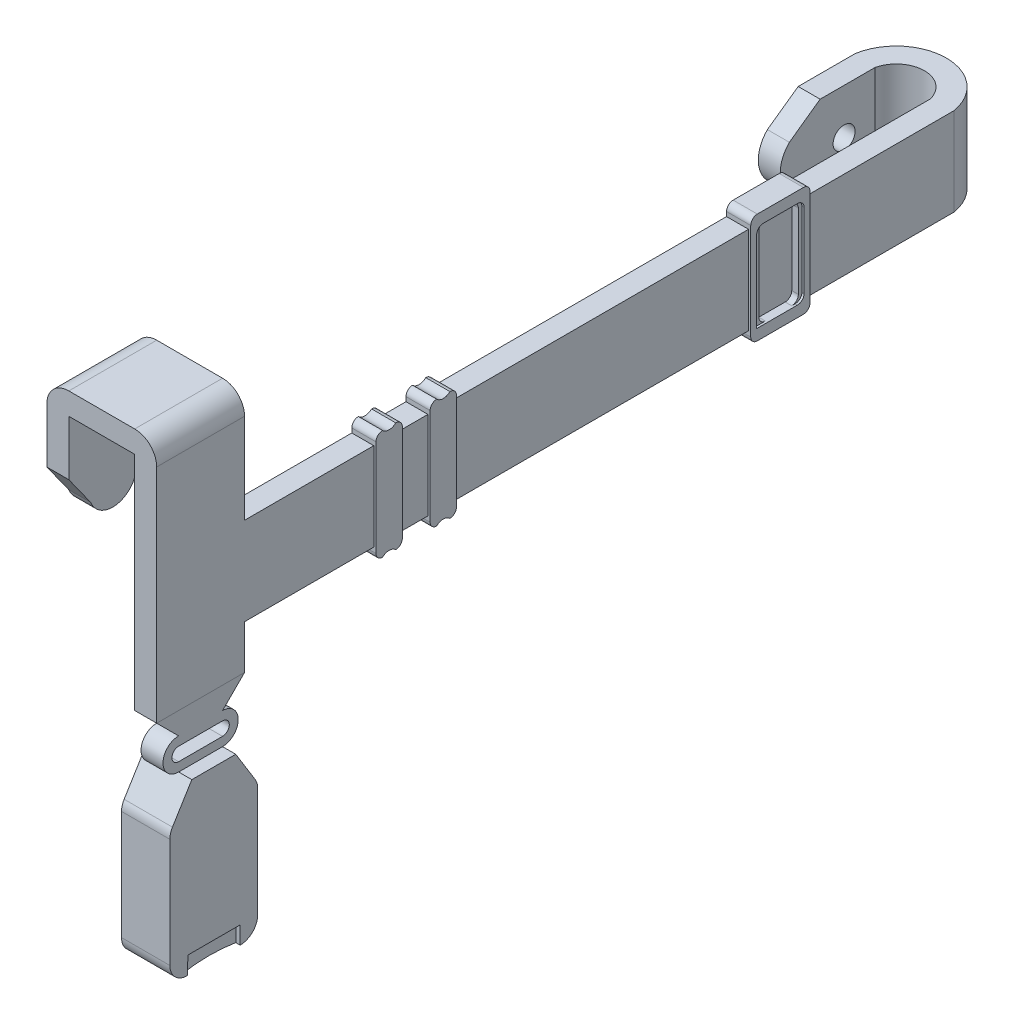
SolidWorks part; units mm, degrees
ref_plane "Alzado" through (0, 0, 0) normal (0, 0, 1) x (1, 0, 0)
ref_plane "Planta" through (0, 0, 0) normal (0, 1, 0) x (1, 0, 0)
ref_plane "Vista lateral" through (0, 0, 0) normal (1, 0, 0) x (0, 0, -1)
sketch "Croquis1" plane through (0, 0, 0) normal (0, 1, 0) x (1, 0, 0)
  line L1 (-25, 0) -> (-25, -25)
  line L2 (0, 0) -> (0, -362) construction
  line L3 (0, 0) -> (0, -362)
  arc A1 (-25, 0) -> (0, 0) centre (-12.5, -2.865) cw
  dimension "D1" = 25
  dimension "D2" = 362
  dimension "D3" = 25
extrude "Extruir-Lámina3" add sketch "Croquis1" along normal blind 40 thin
sketch "Croquis4" plane through (0, 0, 0) normal (0, -1, 0) x (1, 0, 0)
  line L0 (10, 362) -> (0, 362)
  line L1 (0, 362) -> (0, 322)
  line L2 (0, 362) -> (0, 0) construction
  line L3 (0, 322) -> (10, 322)
  line L4 (10, 362) -> (10, -0.9678) construction
  line L5 (10, 322) -> (10, 362)
  dimension "D1" = 40
extrude "Saliente-Extruir1" add sketch "Croquis4" along normal blind 20
sketch "Croquis7" plane through (10, 0, 0) normal (1, 0, 0) x (0, 0, -1)
  line L9 (-341.9992, -17.5299) -> (-341.9992, -36.8702) construction
  line L10 (-351.9992, -30) -> (-341.9992, -30)
  line L11 (-341.9992, -30) -> (-331.9992, -30)
  line L15 (-351.9992, -44.2417) -> (-331.9992, -44.2417)
  line L16 (-351.9992, -37.1208) -> (-331.9992, -37.1208) construction
  line L17 (-351.9992, -34.0699) -> (-331.9992, -34.0699)
  line L18 (-351.9992, -40.1718) -> (-331.9992, -40.1718)
  line L19 (-341.9992, -30) -> (-305.0392, -48.0859) construction
  line L22 (-331.9992, -30) -> (-351.9992, -30)
  line L27 (-362, -30) -> (-362, -45.4611) construction
  line L28 (-351.9992, -30) -> (-362, -20)
  line L29 (-331.9992, -30) -> (-322, -20)
  arc A0 (-351.9992, -30) -> (-351.9992, -44.2417) centre (-351.9992, -37.1208) ccw
  arc A1 (-331.9992, -30) -> (-331.9992, -44.2417) centre (-331.9992, -37.1208) cw
  arc A2 (-351.9992, -34.0699) -> (-351.9992, -40.1718) centre (-351.9992, -37.1208) ccw
  arc A3 (-331.9992, -40.1718) -> (-331.9992, -34.0699) centre (-331.9992, -37.1208) ccw
  point P14 (-341.9992, -37.1208)
  point P19 (-359.12, -37.1208)
  point P26 (-324.8783, -37.1208)
  dimension "D1" = 10
  dimension "D2" = 10
  dimension "D3" = 2.88
sketch "Croquis9" plane through (10, 0, 0) normal (1, 0, 0) x (0, 0, -1)
  line L0 (-362, 40) -> (0.9678, 40) construction
  line L5 (-322, 0) -> (0.9678, 0) construction
  line L6 (-65.6135, 0) -> (-92.587, 0) construction
  line L11 (-68.6135, 45) -> (-89.587, 45)
  line L12 (-65.6135, 42) -> (-65.6135, -2)
  line L13 (-68.6135, -5) -> (-89.587, -5)
  line L14 (-92.587, 42) -> (-92.587, -2)
  line L15 (-58.2022, 40) -> (-121.8422, 40) construction
  line L16 (-65.6135, 45) -> (-92.587, -5) construction
  line L17 (-65.6135, -5) -> (-92.587, 45) construction
  line L18 (-212.9826, 40) -> (-273.7346, 40) construction
  line L19 (-71.3109, 40) -> (-86.8897, 40)
  line L20 (-68.3109, 37) -> (-68.3109, 3)
  line L21 (-71.3109, 0) -> (-89.8897, 0)
  line L22 (-89.8897, 37) -> (-89.8897, 0)
  line L24 (-238.5261, 42) -> (-238.5261, -2)
  line L26 (-226.5261, 42) -> (-226.5261, -2)
  line L28 (-251.1805, 42) -> (-251.1805, -2)
  line L30 (-263.1805, 42) -> (-263.1805, -2)
  line L31 (-216.3577, 0) -> (-269.321, 0) construction
  arc A0 (-89.8897, 37) -> (-86.8897, 40) centre (-86.8897, 37) cw
  arc A1 (-68.6135, 45) -> (-65.6135, 42) centre (-68.6135, 42) cw
  arc A2 (-89.587, 45) -> (-92.587, 42) centre (-89.587, 42) ccw
  arc A3 (-92.587, -2) -> (-89.587, -5) centre (-89.587, -2) ccw
  arc A4 (-68.6135, -5) -> (-65.6135, -2) centre (-68.6135, -2) ccw
  arc A5 (-68.3109, 3) -> (-71.3109, 0) centre (-71.3109, 3) cw
  arc A6 (-71.3109, 40) -> (-68.3109, 37) centre (-71.3109, 37) cw
  arc A7 (-260.1805, 45) -> (-263.1805, 42) centre (-260.1805, 42) ccw
  arc A8 (-254.1805, 45) -> (-251.1805, 42) centre (-254.1805, 42) cw
  arc A9 (-263.1805, -2) -> (-260.1805, -5) centre (-260.1805, -2) ccw
  arc A10 (-251.1805, -2) -> (-254.1805, -5) centre (-254.1805, -2) cw
  arc A11 (-238.5261, -2) -> (-235.5261, -5) centre (-235.5261, -2) ccw
  arc A12 (-229.5261, -5) -> (-226.5261, -2) centre (-229.5261, -2) ccw
  arc A13 (-235.5261, 45) -> (-238.5261, 42) centre (-235.5261, 42) ccw
  arc A14 (-229.5261, 45) -> (-226.5261, 42) centre (-229.5261, 42) cw
  arc A15 (-229.5261, -5) -> (-235.5261, -5) centre (-232.5261, -8) ccw
  arc A16 (-254.1805, -5) -> (-260.1805, -5) centre (-257.1805, -8) ccw
  arc A17 (-254.1805, 45) -> (-260.1805, 45) centre (-257.1805, 48) cw
  arc A18 (-235.5261, 45) -> (-229.5261, 45) centre (-232.5261, 48) ccw
  point P42 (-68.3109, 40)
  point P49 (-263.1805, 45)
  point P52 (-251.1805, 45)
  point P63 (-238.5261, 45)
  point P66 (-226.5261, 45)
  dimension "D5" = 3
  dimension "D6" = 3
  dimension "D1" = 12
  dimension "D2" = 12
  dimension "D3" = 50
  dimension "D4" = 5
extrude "Saliente-Extruir4" add sketch "Croquis9" against normal blind 10 and the other way blind 1
sketch "Croquis10" plane through (10, 0, 0) normal (1, 0, 0) x (0, 0, -1)
  line L5 (-72.9197, 40) -> (-84.9197, 40)
  line L6 (-69.9197, 37) -> (-69.9197, 3)
  line L7 (-72.9197, 0) -> (-84.9197, 0)
  line L8 (-87.9197, 37) -> (-87.9197, 3)
  line L9 (-69.9197, 40) -> (-87.9197, 0) construction
  line L10 (-69.9197, 0) -> (-87.9197, 40) construction
  arc A2 (-87.9197, 3) -> (-84.9197, 0) centre (-84.9197, 3) ccw
  arc A3 (-72.9197, 0) -> (-69.9197, 3) centre (-72.9197, 3) ccw
  arc A4 (-84.9197, 40) -> (-87.9197, 37) centre (-84.9197, 37) ccw
  arc A5 (-72.9197, 40) -> (-69.9197, 37) centre (-72.9197, 37) cw
  point P10 (-78.9197, 20)
  dimension "D2" = 3
  dimension "D1" = 18
extrude "Cortar-Extruir1" cut sketch "Croquis10" against normal blind 3
extrude "Saliente-Extruir6" add sketch "Croquis7" against normal blind 10 separate body
sketch "Croquis16" plane through (0, 40, 0) normal (0, 1, 0) x (1, 0, 0)
  line L0 (0, -362) -> (0, -263.1805) construction
  line L1 (10, -362) -> (0, -362)
  line L2 (10, -362) -> (10, -322)
  line L3 (10, -322) -> (0, -322)
  line L4 (0, -362) -> (0, -322)
  dimension "D1" = 40
extrude "Saliente-Extruir10" add sketch "Croquis16" along normal blind 41
sketch "Croquis19" plane through (-35, 0, 0) normal (-1, 0, 0) x (0, 0, 1)
  circle A0 centre (14.0955, 19.4037) radius 5
  dimension "D1" = 10
extrude "Cortar-Extruir4" cut sketch "Croquis19" against normal blind 10
sketch "Croquis20" plane through (-35, 0, 0) normal (-1, 0, 0) x (0, 0, 1)
  line L0 (39, 30) -> (25, 40)
  line L2 (25, 20) -> (39, 20) construction
  line L3 (25, 40) -> (25, 0) construction
  line L4 (25, 40) -> (25, 0)
  line L5 (25, 0) -> (39, 10)
  arc A0 (39, 30) -> (39, 10) centre (29, 20) cw
  dimension "D1" = 10
  dimension "D2" = 10
  dimension "D3" = 14
extrude "Saliente-Extruir11" add sketch "Croquis20" against normal blind 10
sketch "Croquis23" plane through (0, 81, 0) normal (0, 1, 0) x (1, 0, 0)
  line L0 (0, -322) -> (-39.9791, -322)
  line L1 (0, -362) -> (-39.9791, -362)
  line L2 (-39.9791, -36.2996) -> (-39.9791, -362) construction
  line L3 (-39.9791, -322) -> (-39.9791, -362)
  line L4 (0, -322) -> (10, -322)
  line L5 (10, -322) -> (10, -362)
  line L6 (10, -362) -> (0, -362)
  dimension "D1" = 49.9791
extrude "Saliente-Extruir12" add sketch "Croquis23" along normal blind 10
fillet "Redondeo4" radius 10 1 edges at (10, 91, 342)
sketch "Croquis24" plane through (0, 81, 0) normal (0, -1, 0) x (1, 0, 0)
  line L0 (-39.9791, 362) -> (0, 362) construction
  line L1 (-39.9791, 322) -> (-29.9791, 322)
  line L2 (-39.9791, 322) -> (-39.9791, 362)
  line L3 (-39.9791, 362) -> (-29.9791, 362)
  line L4 (-29.9791, 322) -> (-29.9791, 362)
  dimension "D1" = 10
extrude "Saliente-Extruir13" add sketch "Croquis24" along normal blind 25
fillet "Redondeo5" radius 10 1 edges at (-39.9791, 91, 342)
sketch "Croquis25" plane through (-39.9791, 0, 0) normal (-1, 0, 0) x (0, 0, 1)
  line L0 (322, 56) -> (362, 56)
  line L4 (342, 56) -> (342, 42) construction
  line L5 (362, 56) -> (352, 42)
  line L8 (332, 42) -> (322, 56)
  arc A0 (332, 42) -> (352, 42) centre (342, 45.9494) ccw
  dimension "D1" = 10
  dimension "D2" = 10
  dimension "D3" = 14
extrude "Saliente-Extruir14" add sketch "Croquis25" against normal blind 10
sketch "Croquis27" plane through (10, 0, 0) normal (1, 0, 0) x (0, 0, -1)
  line L0 (-331.9992, -44.2417) -> (-323.1853, -58.5683)
  line L1 (-351.9992, -44.2417) -> (-360.813, -58.5683)
  line L2 (-341.9992, -44.2417) -> (-341.9992, -60.4964) construction
  line L3 (-351.9992, -44.2417) -> (-331.9992, -44.2417) construction
  line L4 (-341.9992, -60.4964) -> (-321.9992, -60.4964) construction
  line L5 (-341.9992, -60.4964) -> (-361.9992, -60.4964) construction
  line L6 (-361.9992, -62.7602) -> (-361.9992, -112.4964)
  line L8 (-321.9992, -112.4964) -> (-321.9992, -62.7602)
  line L9 (-329.9992, -120.4964) -> (-329.9992, -112.4964)
  line L10 (-329.9992, -112.4964) -> (-353.9992, -112.4964)
  line L11 (-353.9992, -112.4964) -> (-353.9992, -120.4964)
  arc A0 (-361.9992, -112.4964) -> (-353.9992, -120.4964) centre (-353.9992, -112.4964) ccw
  arc A1 (-329.9992, -120.4964) -> (-321.9992, -112.4964) centre (-329.9992, -112.4964) ccw
  arc A2 (-360.813, -58.5683) -> (-361.9992, -62.7602) centre (-353.9992, -62.7602) ccw
  arc A3 (-323.1853, -58.5683) -> (-321.9992, -62.7602) centre (-329.9992, -62.7602) cw
  arc A4 (-329.9992, -120.4964) -> (-353.9992, -120.4964) centre (-341.9992, -194.9172) ccw
  point P16 (-361.9992, -120.4964)
  point P19 (-321.9992, -120.4964)
  dimension "D5" = 8
  dimension "D6" = 8
  dimension "D1" = 20
  dimension "D2" = 20
  dimension "D3" = 40
  dimension "D4" = 60
extrude "Saliente-Extruir15" add sketch "Croquis27" against normal blind 16 and the other way blind 6 contours A3 L0 L1 A2 L6 A0 L11 L10 L9 A1 L8 M7 | A4 L9 L10 L11
sketch "Croquis28" plane through (16, 0, 0) normal (1, 0, 0) x (0, 0, -1)
  line L0 (-329.9992, -120.4964) -> (-329.9992, -112.4964)
  line L1 (-329.9992, -112.4964) -> (-353.7833, -112.4964)
  line L2 (-353.7833, -112.4964) -> (-353.9992, -120.4964)
  point P6 (-353.8912, -116.4964)
  dimension "D1" = 8
extrude "Cortar-Extruir5" cut sketch "Croquis28" against normal blind 2 and the other way through all
